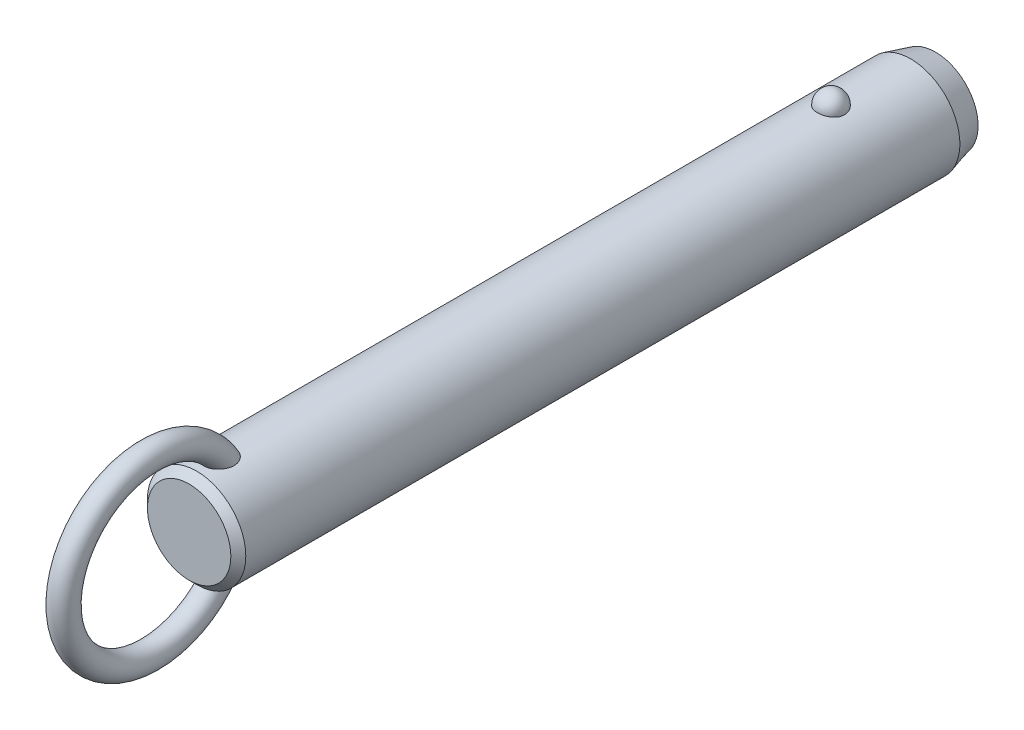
SolidWorks part; units mm, degrees
ref_plane "Front Plane" through (0, 0, 0) normal (0, 0, 1) x (1, 0, 0)
ref_plane "Top Plane" through (0, 0, 0) normal (0, 1, 0) x (1, 0, 0)
ref_plane "Right Plane" through (0, 0, 0) normal (1, 0, 0) x (0, 0, -1)
sketch "Sketch2" plane through (0, 0, 0) normal (0, 0, 1) x (1, 0, 0)
  circle A0 centre (0, 0) radius 7.9
  point P3 (0, 7.9)
  dimension "D1" = 15.8
extrude "Boss-Extrude1" add sketch "Sketch2" along normal blind 91.4
sketch "Sketch3" plane through (0, 0, 0) normal (0, 0, -1) x (-1, 0, 0)
  circle A0 centre (0, 0) radius 7.9
  dimension "D1" = 15.8
extrude "Boss-Extrude2" add sketch "Sketch3" along normal blind 19
chamfer "Chamfer1" distance 4 angle 15 1 edges at (-7.9, 0, -19)
sketch "Sketch12" plane through (0, 0, 0) normal (1, 0, 0) x (0, 0, -1)
  line L0 (-91.4, 7.9) -> (-91.4, -7.9) construction
  point P0 (-91.4, 0)
sketch "Sketch13" plane through (0, 0, 0) normal (1, 0, 0) x (0, 0, -1)
  circle A0 centre (-107.25, 0) radius 15.85
  point P2 (-91.4, 0)
  dimension "D1" = 31.7
sketch "Sketch14" plane through (0, 0, 0) normal (0, 1, 0) x (1, 0, 0)
  circle A0 centre (0, -93.4) radius 2
  point P2 (0, -91.4)
  dimension "D1" = 4
sweep "Sweep1" add profiles "Sketch14" path "Sketch13"
sketch "Sketch15" plane through (0, 0, 91.4) normal (0, 0, 1) x (1, 0, 0)
  circle A0 centre (0, 0) radius 7.9
  dimension "D1" = 15.8
extrude "Boss-Extrude3" add sketch "Sketch15" along normal blind 9.52
chamfer "Chamfer2" distance 1.2 angle 45 1 edges at (7.9, 0, 100.92)
sketch "Sketch18" plane through (0, 0, 0) normal (1, 0, 0) x (0, 0, -1)
  line L0 (15, 7.9) -> (-93.5091, 7.9) construction
  line L1 (2.2, 10.1) -> (2.2, 5.7)
  line L2 (-93.5091, -7.9) -> (15, -7.9) construction
  arc A0 (2.2, 10.1) -> (2.2, 5.7) centre (2.2, 7.9) ccw
  point P4 (0, 7.9)
  dimension "D1" = 18
revolve "Revolve1" add sketch "Sketch18" angle 360 about L1
